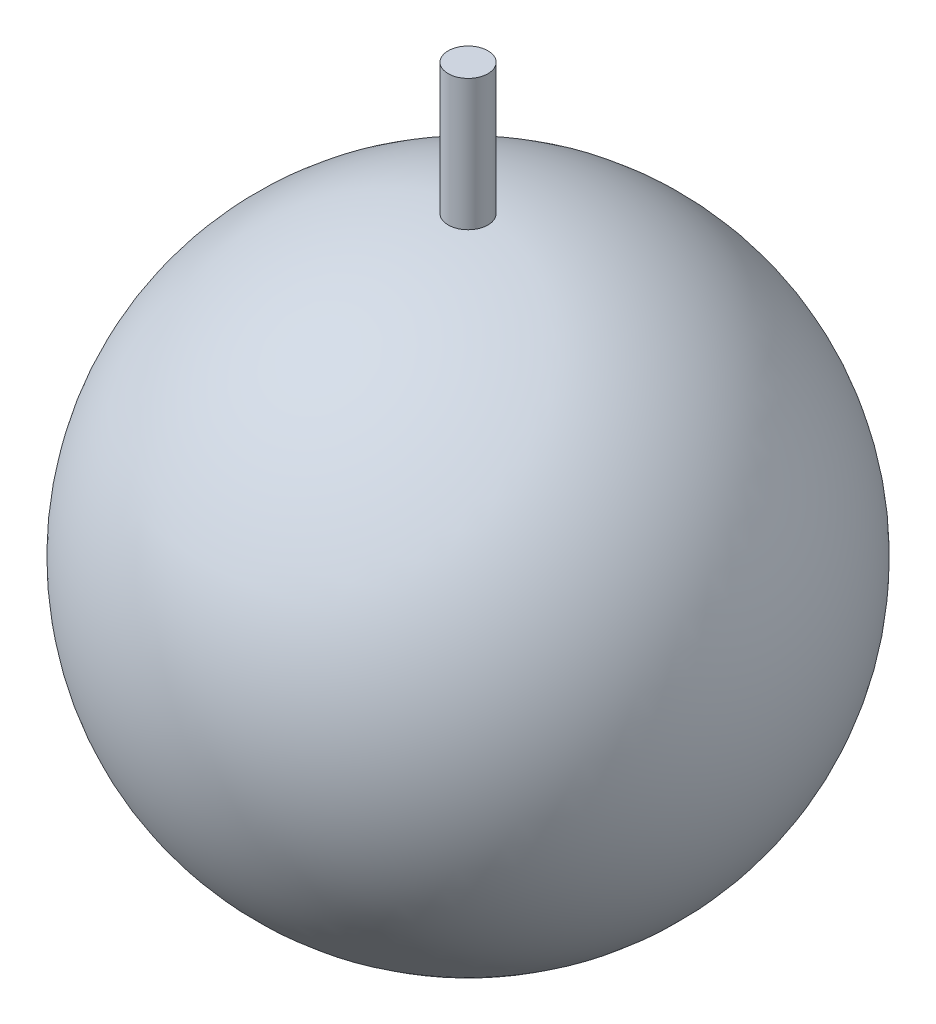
SolidWorks part; units mm, degrees
ref_plane "Plan de face" through (0, 0, 0) normal (0, 0, 1) x (1, 0, 0)
ref_plane "Plan de dessus" through (0, 0, 0) normal (0, 1, 0) x (1, 0, 0)
ref_plane "Plan de droite" through (0, 0, 0) normal (1, 0, 0) x (0, 0, -1)
sketch "Esquisse1" plane through (0, 0, 0) normal (0, 0, 1) x (1, 0, 0)
  line L0 (0, 0) -> (0, 38.5405) construction
  line L1 (-22.5, 0) -> (22.5, 0)
  line L2 (-47.4023, 0) -> (50.1363, 0) construction
  arc A0 (22.5, 0) -> (-22.5, 0) centre (0, 0) ccw
  point P3 (0, 0)
  dimension "D1" = 45
revolve "Révolution1" add sketch "Esquisse1" angle 360 about L1
sketch "Esquisse2" plane through (0, 0, 0) normal (0, -1, 0) x (1, 0, 0)
  circle A0 centre (0, 0) radius 1.5
  dimension "D1" = 3
extrude "Boss.-Extru.1" add sketch "Esquisse2" against normal up to surface (32.35 mm away)
